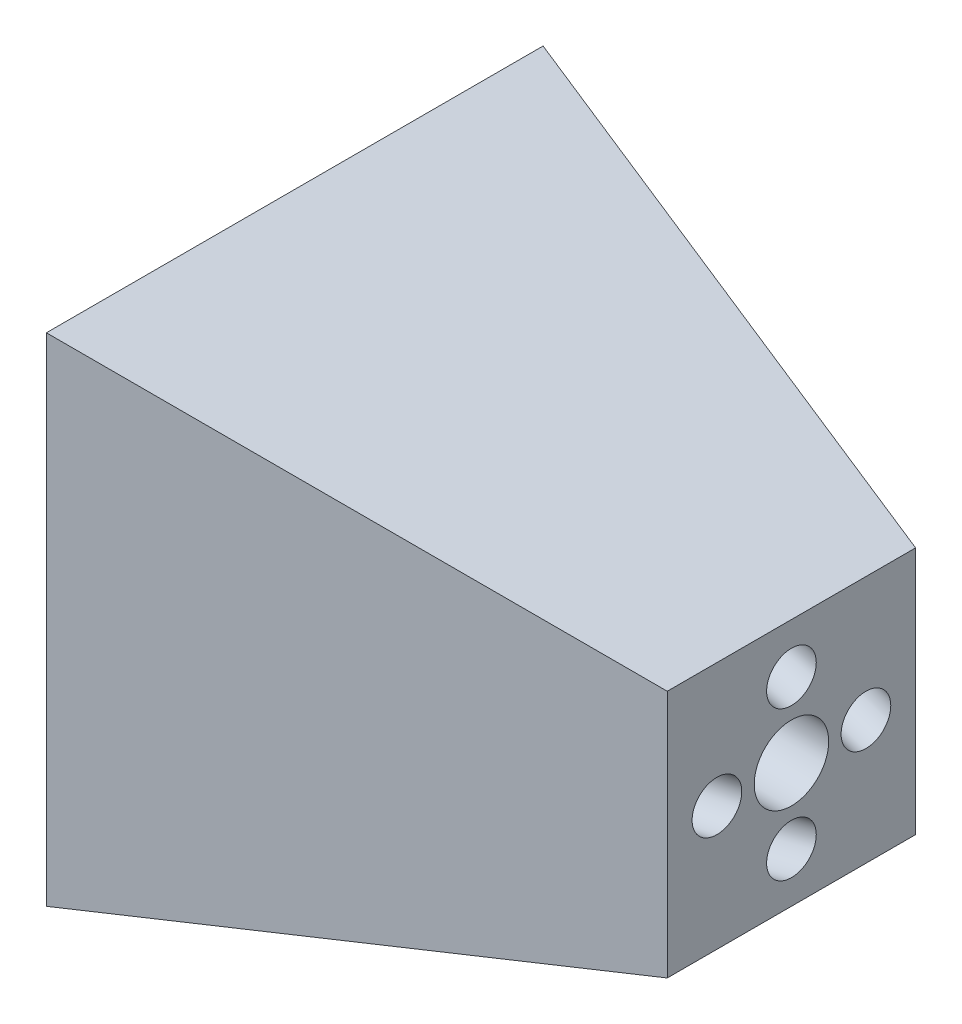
SolidWorks part; units mm, degrees
ref_plane "Front Plane" through (0, 0, 0) normal (0, 0, 1) x (1, 0, 0)
ref_plane "Top Plane" through (0, 0, 0) normal (0, 1, 0) x (1, 0, 0)
ref_plane "Right Plane" through (0, 0, 0) normal (1, 0, 0) x (0, 0, -1)
sketch "Sketch1" plane through (0, 0, 0) normal (1, 0, 0) x (0, 0, -1)
  line L1 (25, 25) -> (-25, 25)
  line L2 (25, 25) -> (25, -25)
  line L3 (25, -25) -> (-25, -25)
  line L4 (-25, 25) -> (-25, -25)
  line L5 (25, 25) -> (-25, -25) construction
  line L6 (25, -25) -> (-25, 25) construction
  point P0 (0, 0)
  dimension "D1" = 50
ref_plane "Plane1" through (-100, 0, 0) normal (1, 0, 0) x (0, 0, -1)
sketch "Sketch2" plane through (-100, 0, 0) normal (1, 0, 0) x (0, 0, -1)
  line L1 (50, 50) -> (-50, 50)
  line L2 (50, 50) -> (50, -50)
  line L3 (50, -50) -> (-50, -50)
  line L4 (-50, 50) -> (-50, -50)
  line L5 (50, 50) -> (-50, -50) construction
  line L6 (50, -50) -> (-50, 50) construction
  point P0 (0, 0)
  dimension "D1" = 100
loft "Loft1" add profiles "Sketch1", "Sketch2"
sketch "Sketch3" plane through (0, 0, 0) normal (1, 0, 0) x (0, 0, -1)
  circle A0 centre (15, 0) radius 5
  circle A1 centre (0, -15) radius 5 construction
  circle A2 centre (-15, 0) radius 5 construction
  circle A3 centre (0, 15) radius 5 construction
  point P12 (0, 0)
  dimension "D1" = 10
  dimension "D2" = 15
  dimension "D3" = 4
sketch "Sketch4" plane through (0, 0, 0) normal (0, 1, 0) x (1, 0, 0)
  line L0 (0, 15) -> (-100, 40)
  line L1 (0, 10) -> (0, 20) construction
  line L2 (-100, 50) -> (-100, -50) construction
  line L3 (0, 25) -> (-100, 50) construction
  line L5 (0, 0) -> (-133.0226, 0) construction
  line L6 (0, -15) -> (-100, -40)
sketch "Sketch5" plane through (0, 0, 0) normal (0, 0, 1) x (1, 0, 0)
  line L0 (0, 15) -> (-100, 40)
  line L1 (0, 10) -> (0, 20) construction
  line L2 (-100, 50) -> (-100, -50) construction
  line L3 (0, 25) -> (-100, 50) construction
  line L4 (0, 0) -> (34.2438, 0) construction
  line L5 (0, -15) -> (-100, -40)
sweep "Cut-Sweep2" cut profiles "Sketch3" path "Sketch4"
sketch "Sketch6" plane through (0, 0, 0) normal (1, 0, 0) x (0, 0, -1)
  circle A0 centre (0, 15) radius 5 construction
  circle A1 centre (15, 0) radius 5
  circle A2 centre (15, 0) radius 5 construction
  circle A3 centre (0, 15) radius 5
  dimension "D1" = 0
sweep "Cut-Sweep3" cut profiles "Sketch6" path "Sketch5"
mirror "Mirror1" about plane through (0, 0, 0) normal (0, 0, 1) of "Cut-Sweep2"
mirror "Mirror2" about plane through (0, 0, 0) normal (0, 1, 0) of "Cut-Sweep3"
sketch "Sketch7" plane through (0, 0, 0) normal (1, 0, 0) x (0, 0, -1)
  circle A0 centre (0, 0) radius 7.5
  dimension "D1" = 15
extrude "Cut-Extrude1" cut sketch "Sketch7" against normal through all
